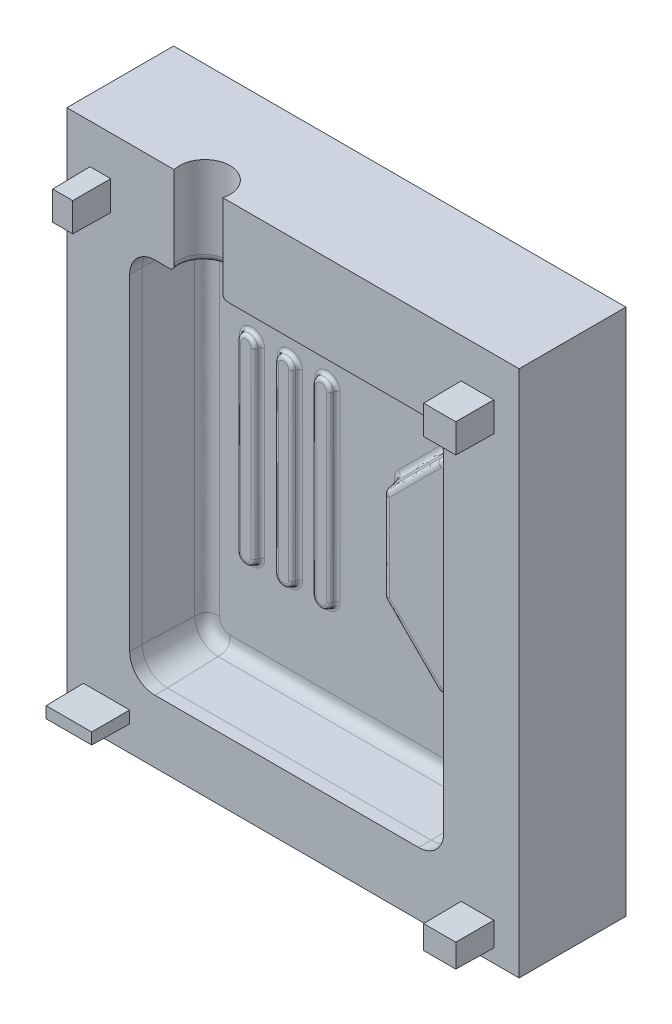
SolidWorks part; units mm, degrees
ref_plane "Front Plane" through (0, 0, 0) normal (0, 0, 1) x (1, 0, 0)
ref_plane "Top Plane" through (0, 0, 0) normal (0, 1, 0) x (1, 0, 0)
ref_plane "Right Plane" through (0, 0, 0) normal (1, 0, 0) x (0, 0, -1)
sketch "Sketch1" plane through (0, 0, 0) normal (0, 0, 1) x (1, 0, 0)
  line L1 (0, 0) -> (250, 0)
  line L2 (0, 0) -> (0, 300)
  line L3 (0, 300) -> (250, 300)
  line L4 (250, 0) -> (250, 300)
  dimension "D1" = 250
  dimension "D2" = 300
sketch "Sketch2" plane through (0, 0, 0) normal (0, 0, 1) x (1, 0, 0)
  line L0 (0, 280) -> (0, 20)
  line L1 (20, 0) -> (230, 0)
  line L2 (250, 20) -> (250, 280)
  line L3 (230, 300) -> (70, 300)
  line L4 (35, 300) -> (35, 320)
  line L5 (35, 320) -> (70, 320)
  line L6 (70, 320) -> (70, 300)
  line L8 (215, 67.5) -> (200, 67.5)
  line L9 (200, 67.5) -> (155, 112.5)
  line L10 (155, 112.5) -> (155, 187.5)
  line L11 (155, 187.5) -> (200, 232.5)
  line L12 (200, 232.5) -> (215, 232.5)
  line L13 (215, 150) -> (155, 150) construction
  line L14 (215, 232.5) -> (215, 67.5)
  line L15 (35, 300) -> (20, 300)
  arc A0 (0, 20) -> (20, 0) centre (20, 20) ccw
  arc A1 (230, 0) -> (250, 20) centre (230, 20) ccw
  arc A2 (250, 280) -> (230, 300) centre (230, 280) ccw
  arc A3 (0, 280) -> (20, 300) centre (20, 280) cw
  point P10 (0, 0)
  point P13 (250, 0)
  point P16 (250, 300)
  point P19 (0, 300)
  point P34 (250, 150)
  dimension "D1" = 20
  dimension "D2" = 35
  dimension "D3" = 165
  dimension "D4" = 15
  dimension "D5" = 60
  dimension "D6" = 35
  dimension "D7" = 20
  dimension "D8" = 15
sketch "Sketch3" plane through (0, 0, 0) normal (0, 0, 1) x (1, 0, 0)
  line L0 (230, 300) -> (70, 300) construction
  line L4 (35, 300) -> (20, 300) construction
  line L5 (0, 280) -> (0, 20) construction
  line L6 (20, 0) -> (230, 0) construction
  line L7 (250, 20) -> (250, 280) construction
  line L8 (230, 300) -> (70, 300)
  line L12 (70, 300) -> (20, 300)
  line L13 (0, 280) -> (0, 20)
  line L14 (20, 0) -> (230, 0)
  line L15 (250, 20) -> (250, 280)
  arc A0 (20, 300) -> (0, 280) centre (20, 280) ccw construction
  arc A1 (0, 20) -> (20, 0) centre (20, 20) ccw construction
  arc A2 (230, 0) -> (250, 20) centre (230, 20) ccw construction
  arc A3 (250, 280) -> (230, 300) centre (230, 280) ccw construction
  arc A4 (20, 300) -> (0, 280) centre (20, 280) ccw
  arc A5 (0, 20) -> (20, 0) centre (20, 20) ccw
  arc A6 (230, 0) -> (250, 20) centre (230, 20) ccw
  arc A7 (250, 280) -> (230, 300) centre (230, 280) ccw
extrude "Boss-Extrude1" add sketch "Sketch3" along normal blind 50 draft 2
sketch "Sketch4" plane through (0, 0, 50) normal (0, 0, 1) x (1, 0, 0)
  line L0 (215, 232.5) -> (215, 67.5) construction
  line L1 (215, 67.5) -> (200, 67.5) construction
  line L2 (200, 67.5) -> (155, 112.5) construction
  line L3 (155, 112.5) -> (155, 187.5) construction
  line L4 (155, 187.5) -> (200, 232.5) construction
  line L5 (200, 232.5) -> (215, 232.5) construction
  line L6 (215, 232.5) -> (215, 67.5)
  line L7 (215, 67.5) -> (200, 67.5)
  line L8 (200, 67.5) -> (155, 112.5)
  line L9 (155, 112.5) -> (155, 187.5)
  line L10 (155, 187.5) -> (200, 232.5)
  line L11 (200, 232.5) -> (215, 232.5)
extrude "Cut-Extrude1" cut sketch "Sketch4" against normal blind 15 draft 10
sketch "Sketch5" plane through (0, 0, 50) normal (0, 0, 1) x (1, 0, 0)
  line L0 (37.5, 222.5) -> (37.5, 77.5) construction
  line L1 (45, 222.5) -> (45, 77.5)
  line L2 (30, 222.5) -> (30, 77.5)
  line L4 (37.5, 150) -> (142.9758, 150) construction
  line L5 (67.5, 222.5) -> (67.5, 77.5) construction
  line L6 (75, 222.5) -> (75, 77.5)
  line L7 (60, 222.5) -> (60, 77.5)
  line L8 (97.5, 222.5) -> (97.5, 77.5) construction
  line L9 (105, 222.5) -> (105, 77.5)
  line L10 (90, 222.5) -> (90, 77.5)
  arc A0 (45, 222.5) -> (30, 222.5) centre (37.5, 222.5) ccw
  arc A1 (30, 77.5) -> (45, 77.5) centre (37.5, 77.5) ccw
  arc A2 (75, 222.5) -> (60, 222.5) centre (67.5, 222.5) ccw
  arc A3 (60, 77.5) -> (75, 77.5) centre (67.5, 77.5) ccw
  arc A4 (105, 222.5) -> (90, 222.5) centre (97.5, 222.5) ccw
  arc A5 (90, 77.5) -> (105, 77.5) centre (97.5, 77.5) ccw
  point P2 (37.5, 150)
  point P15 (67.5, 150)
  point P22 (97.5, 150)
  dimension "D1" = 15
  dimension "D2" = 145
  dimension "D3" = 30
  dimension "D4" = 3
extrude "Cut-Extrude2" cut sketch "Sketch5" against normal blind 5 draft 10
fillet "Fillet1" radius 10 8 edges at (242.9075, 292.9075, 50) (248.254, 150, 50) (242.9075, 7.0925, 50) (125, 1.746, 50) (7.0925, 7.0925, 50) (1.746, 150, 50) (7.0925, 292.9075, 50) (125, 298.254, 50)
sketch "Sketch6" plane through (0, 0, 0) normal (0, 0, -1) x (-1, 0, 0)
  line L4 (-250, 280) -> (-250, 20)
  line L5 (-230, 0) -> (-20, 0)
  line L6 (0, 20) -> (0, 280)
  line L7 (-20, 300) -> (-230, 300)
  line L8 (-250, 280) -> (-250, 20)
  line L9 (-230, 0) -> (-20, 0)
  line L10 (0, 20) -> (0, 280)
  line L11 (-20, 300) -> (-230, 300)
  arc A4 (-230, 300) -> (-250, 280) centre (-230, 280) ccw
  arc A5 (-250, 20) -> (-230, 0) centre (-230, 20) ccw
  arc A6 (-20, 0) -> (0, 20) centre (-20, 20) ccw
  arc A7 (0, 280) -> (-20, 300) centre (-20, 280) ccw
  arc A8 (-230, 300) -> (-250, 280) centre (-230, 280) ccw
  arc A9 (-250, 20) -> (-230, 0) centre (-230, 20) ccw
  arc A10 (-20, 0) -> (0, 20) centre (-20, 20) ccw
  arc A11 (0, 280) -> (-20, 300) centre (-20, 280) ccw
  dimension "D1" = 0
extrude "Boss-Extrude2" add sketch "Sketch6" along normal blind 5
fillet "Fillet2" radius 5 18 edges at (155, 150, 50) (177.5, 90, 50) (177.5, 210, 50) (207.5, 67.5, 50) (207.5, 232.5, 50) (212.3551, 150, 35) (206.7253, 70.1449, 35) (179.3702, 91.8702, 35) (157.6449, 150, 35) (179.3702, 208.1298, 35) (206.7253, 229.8551, 35) (215, 150, 50) (200.5478, 231.1775, 42.5) (156.3225, 113.0478, 42.5) (200.5478, 68.8225, 42.5) (213.6775, 68.8225, 42.5) (213.6775, 231.1775, 42.5) (156.3225, 186.9522, 42.5)
fillet "Fillet3" radius 3 24 edges at (37.5, 70, 50) (30, 150, 50) (37.5, 230, 50) (67.5, 70, 50) (60, 150, 50) (67.5, 230, 50) (97.5, 70, 50) (90, 150, 50) (97.5, 230, 50) (45, 150, 50) (75, 150, 50) (97.5, 229.1184, 45) (90.8816, 150, 45) (97.5, 70.8816, 45) (67.5, 229.1184, 45) (60.8816, 150, 45) (67.5, 70.8816, 45) (37.5, 229.1184, 45) (30.8816, 150, 45) (37.5, 70.8816, 45) (44.1184, 150, 45) (74.1184, 150, 45) (105, 150, 50) (104.1184, 150, 45)
mirror "Mirror1" about plane through (230, 280, -5) normal (0, 0, -1)
sketch "Sketch7" plane through (0, 300, 0) normal (0, 1, 0) x (1, 0, 0)
  circle A0 centre (54.8055, 5) radius 20
  dimension "D1" = 40
  dimension "D2" = 5
  dimension "D3" = 54.8055
extrude "Boss-Extrude3" add sketch "Sketch7" along normal mid plane 40
fillet "Fillet4" radius 5 4 edges at (34.8055, 300, -5) (54.8055, 299.4762, 15) (74.8055, 300, -5) (54.8055, 299.4762, -25)
shell "Shell1" thickness 4
sketch "Sketch10" plane through (0, 320, 0) normal (0, 1, 0) x (1, 0, 0)
  circle A1 centre (54.8055, 5) radius 20
  circle A3 centre (54.8055, 5) radius 20
  dimension "D1" = 0
extrude "Boss-Extrude6" add sketch "Sketch10" along normal blind 80
sketch "Sketch8" plane through (0, 0, 0) normal (0, 0, 1) x (1, 0, 0)
  line L1 (-50, -50) -> (310, -50)
  line L2 (-50, -50) -> (-50, 370)
  line L3 (-50, 370) -> (310, 370)
  line L4 (310, -50) -> (310, 370)
  dimension "D1" = 50
  dimension "D2" = 50
  dimension "D3" = 360
  dimension "D4" = 420
extrude "Boss-Extrude4" add sketch "Sketch8" against normal blind 85 separate body
sketch "Sketch9" plane through (0, 0, 0) normal (0, 0, 1) x (1, 0, 0)
  line L1 (-31.5724, 338.5114) -> (-15.0677, 338.5114)
  line L2 (-31.5724, 338.5114) -> (-31.5724, 315.0573)
  line L3 (-31.5724, 315.0573) -> (-15.0677, 315.0573)
  line L4 (-15.0677, 338.5114) -> (-15.0677, 315.0573)
  line L5 (263.775, 338.5114) -> (289.835, 338.5114)
  line L6 (263.775, 338.5114) -> (263.775, 315.0573)
  line L7 (263.775, 315.0573) -> (289.835, 315.0573)
  line L8 (289.835, 338.5114) -> (289.835, 315.0573)
  line L9 (263.775, -20.2487) -> (289.835, -20.2487)
  line L10 (263.775, -20.2487) -> (263.775, -39.3594)
  line L11 (263.775, -39.3594) -> (289.835, -39.3594)
  line L12 (289.835, -20.2487) -> (289.835, -39.3594)
  line L13 (0, -29.8041) -> (-36.7844, -29.8041)
  line L14 (0, -29.8041) -> (0, -20.2487)
  line L15 (0, -20.2487) -> (-36.7844, -20.2487)
  line L16 (-36.7844, -29.8041) -> (-36.7844, -20.2487)
extrude "Boss-Extrude5" add sketch "Sketch9" along normal blind 30 draft 0.5
combine bodies "Combine3" operation type subtract main body 108 bodies to subtract 110
